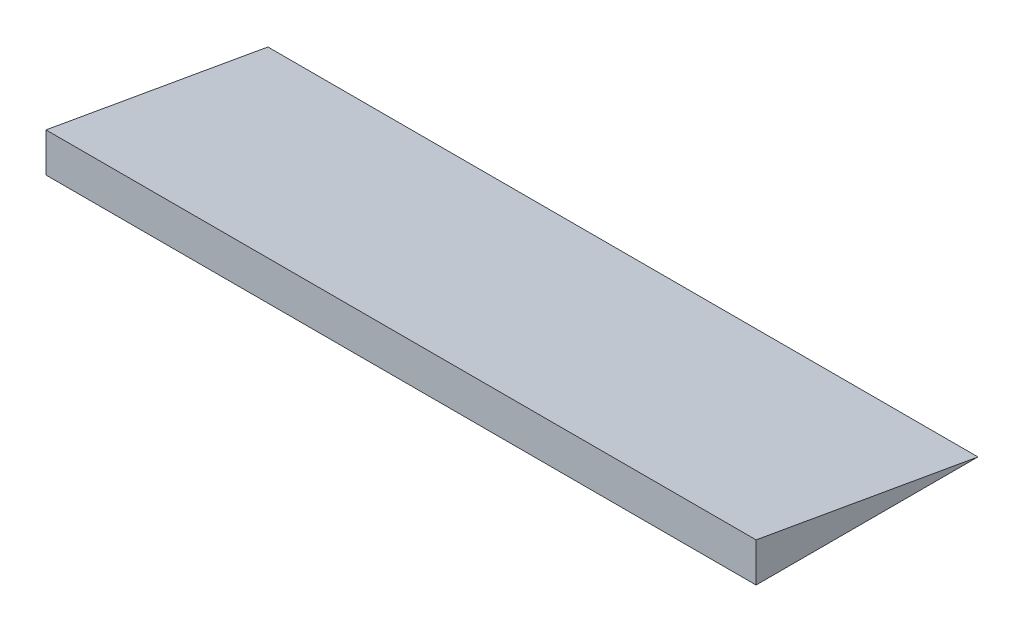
SolidWorks part; units mm, degrees
ref_plane "Plan de face" through (0, 0, 0) normal (0, 0, 1) x (1, 0, 0)
ref_plane "Plan de dessus" through (0, 0, 0) normal (0, 1, 0) x (1, 0, 0)
ref_plane "Plan de droite" through (0, 0, 0) normal (1, 0, 0) x (0, 0, -1)
sketch "Esquisse1" plane through (0, 0, 0) normal (1, 0, 0) x (0, 0, -1)
  line L0 (0, 0) -> (500, 0)
  line L1 (500, 0) -> (0, 88.1635)
  line L2 (0, 0) -> (0, 88.1635)
  dimension "D1" = 10
  dimension "D2" = 500
extrude "Boss.-Extru.1" add sketch "Esquisse1" along normal blind 1600
sketch "Esquisse2" plane through (0, 0, 0) normal (0, -1, 0) x (1, 0, 0)
  line L0 (800, -500) -> (800, 0) construction
  line L1 (1600, -500) -> (0, -500) construction
  line L2 (1600, 0) -> (0, 0) construction
  line L3 (800, -250) -> (258.9561, -250) construction
  circle A0 centre (550, -250) radius 5
  circle A1 centre (1050, -250) radius 5
  dimension "D1" = 250
extrude "Enlèv. mat.-Extru.1" cut sketch "Esquisse2" against normal blind 10
